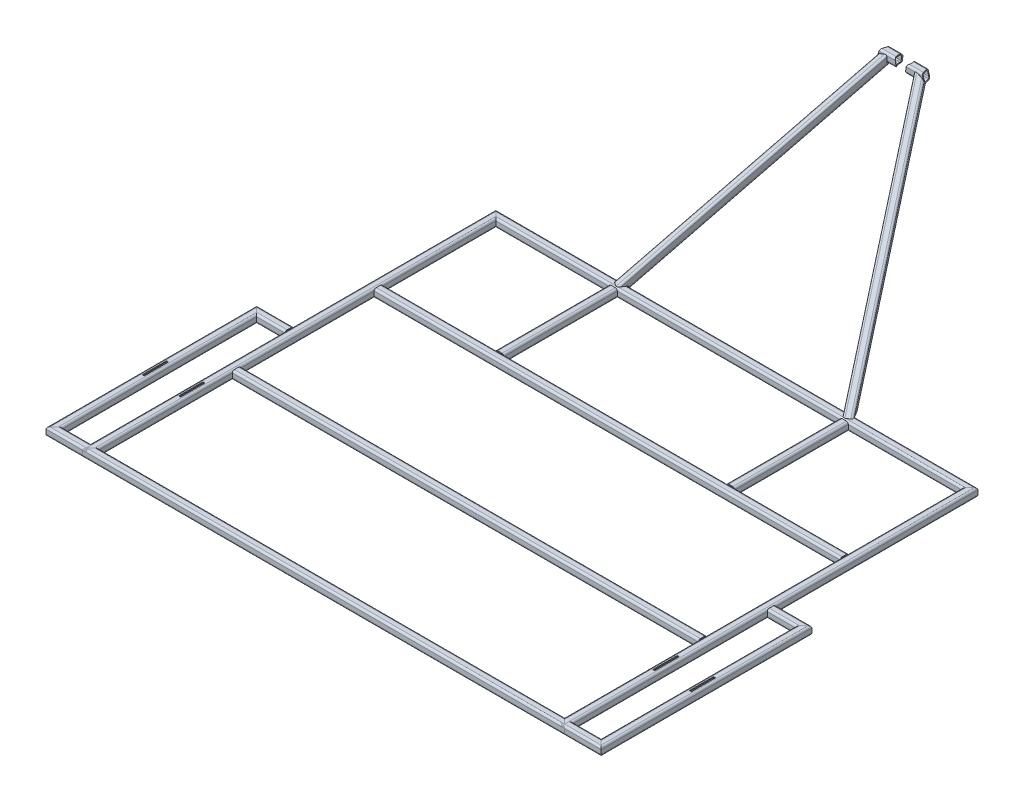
SolidWorks part; units mm, degrees
ref_plane "Front Plane" through (0, 0, 0) normal (0, 0, 1) x (1, 0, 0)
ref_plane "Top Plane" through (0, 0, 0) normal (0, 1, 0) x (1, 0, 0)
ref_plane "Right Plane" through (0, 0, 0) normal (1, 0, 0) x (0, 0, -1)
sketch3d "3DSketch1"
  line L0 (-742.95, 0, -254) -> (742.95, 0, -254)
  line L1 (-742.95, 0, -635) -> (-742.95, 0, 635)
  line L2 (-742.95, 0, -635) -> (742.95, 0, -635)
  line L3 (742.95, 0, -635) -> (742.95, 0, 635)
  line L4 (-742.95, 0, 635) -> (742.95, 0, 635)
  line L5 (-742.95, 0, -635) -> (742.95, 0, 635) construction
  line L6 (742.95, 0, -635) -> (-742.95, 0, 635) construction
  line L7 (742.95, 0, 190.5) -> (-742.95, 0, 190.5)
  line L8 (361.95, 0, -635) -> (361.95, 0, -254)
  line L9 (-361.95, 0, -635) -> (-361.95, 0, -254)
  line L10 (742.95, 0, 635) -> (857.25, 0, 635)
  line L11 (857.25, 0, 0) -> (742.95, 0, 0)
  line L12 (857.25, 0, 635) -> (857.25, 0, 0)
  line L13 (-857.25, 0, 0) -> (-742.95, 0, 0)
  line L14 (-742.95, 0, 635) -> (-857.25, 0, 635)
  line L15 (-857.25, 0, 0) -> (-857.25, 0, 635)
  line L16 (361.95, 0, -444.5) -> (-361.95, 0, -444.5) construction
  line L18 (-50.8, 522.1717, -1173.9276) -> (50.8, 522.1717, -1173.9276)
  line L19 (-361.95, 0, -635) -> (-50.8, 522.1717, -1173.9276)
  line L20 (361.95, 0, -635) -> (50.8, 0, -1173.9276) construction
  line L21 (361.95, 0, -635) -> (50.8, 522.1717, -1173.9276)
  line L22 (309.5644, 0, -604.7552) -> (414.3356, 0, -665.2448) construction
  line L23 (-361.95, 0, -635) -> (361.95, 0, -635) construction
  line L24 (-309.5644, 0, -604.7552) -> (-414.3356, 0, -665.2448) construction
  point P21 (0, 0, -444.5)
  point P23 (0, 0, -635)
  point P28 (0, 522.1717, -1173.9276)
  point P33 (361.95, 0, -635)
  point P34 (-361.95, 0, -635)
other "Sq_rect_tubing_weldment_profiles SQ TUBE 1 X 1 X .120 WALL(1)"
ref_plane "Plane1" through (-742.95, 0, 635) normal (1, 0, 0) x (0, 0, -1)
sketch "Sketch12" plane through (-742.95, 0, 635) normal (1, 0, 0) x (0, 0, -1)
  line L0 (-6.604, -9.652) -> (6.604, -9.652)
  line L1 (-9.652, -6.604) -> (-9.652, 6.604)
  line L2 (6.604, 9.652) -> (-6.604, 9.652)
  line L3 (9.652, 6.604) -> (9.652, -6.604)
  line L4 (-6.604, -12.7) -> (6.604, -12.7)
  line L5 (-12.7, -6.604) -> (-12.7, 6.604)
  line L6 (6.604, 12.7) -> (-6.604, 12.7)
  line L7 (12.7, 6.604) -> (12.7, -6.604)
  line L8 (-12.7, 0) -> (-9.652, 0) construction
  line L9 (-9.652, 0) -> (9.652, 0) construction
  line L10 (9.652, 0) -> (12.7, 0) construction
  line L11 (0, 12.7) -> (0, 9.652) construction
  line L12 (0, 9.652) -> (0, -9.652) construction
  line L13 (0, -9.652) -> (0, -12.7) construction
  arc A0 (12.7, 6.604) -> (6.604, 12.7) centre (6.604, 6.604) ccw
  arc A1 (6.604, -12.7) -> (12.7, -6.604) centre (6.604, -6.604) ccw
  arc A2 (-12.7, -6.604) -> (-6.604, -12.7) centre (-6.604, -6.604) ccw
  arc A3 (-6.604, 12.7) -> (-12.7, 6.604) centre (-6.604, 6.604) ccw
  arc A4 (-6.604, 9.652) -> (-9.652, 6.604) centre (-6.604, 6.604) ccw
  arc A5 (9.652, 6.604) -> (6.604, 9.652) centre (6.604, 6.604) ccw
  arc A6 (6.604, -9.652) -> (9.652, -6.604) centre (6.604, -6.604) ccw
  arc A7 (-9.652, -6.604) -> (-6.604, -9.652) centre (-6.604, -6.604) ccw
  point P6 (-12.7, -12.7)
  point P33 (-12.7, 12.7)
  point P34 (12.7, 12.7)
  point P35 (12.7, 12.7)
  point P36 (12.7, -12.7)
  point P37 (0, 0)
  point P38 (12.7, -12.7)
  point P39 (-12.7, -12.7)
  point P40 (-12.7, 12.7)
  point P41 (-19.05, 0)
  point P42 (0, 19.05)
  point P43 (0, -19.05)
  point P44 (19.05, 0)
  point P45 (0, 0)
sketch "Sketch123" plane through (0, 12.7, 0) normal (0, 1, 0) x (1, 0, 0)
  line L0 (-749.554, -641.604) -> (-736.346, -628.396) construction
  line L1 (-736.346, -628.396) -> (-736.346, 628.396) construction
  line L2 (-736.346, 628.396) -> (-749.554, 641.604) construction
  line L3 (-749.554, 641.604) -> (-749.554, -641.604) construction
  line L4 (-850.646, -6.604) -> (-863.854, 6.604) construction
  line L5 (-863.854, 6.604) -> (-863.854, -641.604) construction
  line L6 (-863.854, -641.604) -> (-850.646, -628.396) construction
  line L7 (-850.646, -628.396) -> (-850.646, -6.604) construction
  line L8 (-749.554, -641.604) -> (-736.346, -628.396) construction
  line L9 (-736.346, -628.396) -> (-736.346, 628.396) construction
  line L10 (755.65, 647.7) -> (749.554, 641.604) construction
  line L11 (-736.346, 628.396) -> (-749.554, 641.604) construction
  line L12 (-749.554, 641.604) -> (-749.554, -641.604) construction
  line L13 (-850.646, -6.604) -> (-863.854, 6.604) construction
  line L14 (736.346, 628.396) -> (730.25, 622.3) construction
  line L15 (-863.854, 6.604) -> (-863.854, -641.604) construction
  line L17 (-863.854, -641.604) -> (-850.646, -628.396) construction
  line L18 (-730.25, 622.3) -> (-736.346, 628.396) construction
  line L19 (-850.646, -628.396) -> (-850.646, -6.604) construction
  line L21 (-863.854, -317.5) -> (-736.346, -317.5) construction
  line L22 (-749.554, 641.604) -> (-755.65, 647.7) construction
  line L23 (-800.1, -380.3051) -> (-800.1, -254.6949) construction
  line L24 (-857.25, 0) -> (-857.25, -635) construction
  line L25 (-860.425, -355.6) -> (-854.075, -355.6)
  line L26 (-860.425, -355.6) -> (-860.425, -279.4)
  line L27 (-860.425, -279.4) -> (-854.075, -279.4)
  line L28 (-854.075, -355.6) -> (-854.075, -279.4)
  line L29 (-860.425, -355.6) -> (-854.075, -279.4) construction
  line L30 (-860.425, -279.4) -> (-854.075, -355.6) construction
  line L31 (-739.775, -279.4) -> (-746.125, -279.4)
  line L42 (755.65, 647.7) -> (749.554, 641.604) construction
  line L46 (736.346, 628.396) -> (730.25, 622.3) construction
  line L50 (-730.25, 622.3) -> (-736.346, 628.396) construction
  line L54 (-749.554, 641.604) -> (-755.65, 647.7) construction
  line L64 (-746.125, -355.6) -> (-746.125, -279.4)
  line L65 (-739.775, -355.6) -> (-746.125, -355.6)
  line L70 (-739.775, -355.6) -> (-739.775, -279.4)
  line L71 (860.425, -279.4) -> (854.075, -355.6) construction
  line L72 (860.425, -355.6) -> (854.075, -279.4) construction
  line L77 (0, 0) -> (0, -50000) construction
  line L86 (800.1, -380.3051) -> (800.1, -254.6949) construction
  line L87 (863.854, -317.5) -> (736.346, -317.5) construction
  line L88 (739.775, -355.6) -> (739.775, -279.4)
  line L89 (739.775, -355.6) -> (746.125, -355.6)
  line L90 (746.125, -355.6) -> (746.125, -279.4)
  line L91 (739.775, -279.4) -> (746.125, -279.4)
  line L92 (854.075, -355.6) -> (854.075, -279.4)
  line L93 (860.425, -279.4) -> (854.075, -279.4)
  line L94 (860.425, -355.6) -> (860.425, -279.4)
  line L95 (860.425, -355.6) -> (854.075, -355.6)
  point P8 (-857.25, -317.5)
  point P13 (-800.1, -317.5)
  point P42 (800.1, -317.5)
  point P43 (857.25, -317.5)
  dimension "D1" = 6.35
  dimension "D2" = 76.2
extrude "Cut-Extrude1" cut sketch "Sketch123" against normal up to surface (25.4 mm away)
sketch3d "3DSketch2" [suppressed]
  line L0 (361.95, 0, -635) -> (361.95, 12.7, -635) construction
  line L1 (-361.95, 0, -635) -> (-361.95, 12.7, -635) construction
  line L2 (-361.95, 12.7, -635) -> (-50.8, 534.5064, -1312.1512)
  line L3 (-50.8, 534.5064, -1312.1512) -> (50.8, 534.5064, -1312.1512)
  line L4 (361.95, 12.7, -635) -> (50.8, 534.5064, -1312.1512)
  line L5 (-361.95, 12.7, -635) -> (361.95, 12.7, -635) construction
  line L6 (361.95, 12.7, -635) -> (50.8, 12.7, -1312.1512) construction
  line L7 (-361.95, 12.7, -635) -> (-366.2937, 5.4156, -625.547)
  line L8 (361.95, 12.7, -635) -> (366.2937, 5.4156, -625.547)
  point P8 (0, 534.5064, -1312.1512)
other "Sq_rect_tubing_weldment_profiles SQ TUBE 1 X 1 X .120 WALL(7)"
ref_plane "Plane3" through (-50.8, 534.8717, -1173.9276) normal (1, 0, 0) x (0, 0, -1)
sketch "Sketch126" plane through (-50.8, 534.8717, -1173.9276) normal (1, 0, 0) x (0, 0, -1)
  line L0 (-6.604, -9.652) -> (6.604, -9.652)
  line L1 (-9.652, -6.604) -> (-9.652, 6.604)
  line L2 (6.604, 9.652) -> (-6.604, 9.652)
  line L3 (9.652, 6.604) -> (9.652, -6.604)
  line L4 (-6.604, -12.7) -> (6.604, -12.7)
  line L5 (-12.7, -6.604) -> (-12.7, 6.604)
  line L6 (6.604, 12.7) -> (-6.604, 12.7)
  line L7 (12.7, 6.604) -> (12.7, -6.604)
  line L8 (-12.7, 0) -> (-9.652, 0) construction
  line L9 (-9.652, 0) -> (9.652, 0) construction
  line L10 (9.652, 0) -> (12.7, 0) construction
  line L11 (0, 12.7) -> (0, 9.652) construction
  line L12 (0, 9.652) -> (0, -9.652) construction
  line L13 (0, -9.652) -> (0, -12.7) construction
  arc A0 (12.7, 6.604) -> (6.604, 12.7) centre (6.604, 6.604) ccw
  arc A1 (6.604, -12.7) -> (12.7, -6.604) centre (6.604, -6.604) ccw
  arc A2 (-12.7, -6.604) -> (-6.604, -12.7) centre (-6.604, -6.604) ccw
  arc A3 (-6.604, 12.7) -> (-12.7, 6.604) centre (-6.604, 6.604) ccw
  arc A4 (-6.604, 9.652) -> (-9.652, 6.604) centre (-6.604, 6.604) ccw
  arc A5 (9.652, 6.604) -> (6.604, 9.652) centre (6.604, 6.604) ccw
  arc A6 (6.604, -9.652) -> (9.652, -6.604) centre (6.604, -6.604) ccw
  arc A7 (-9.652, -6.604) -> (-6.604, -9.652) centre (-6.604, -6.604) ccw
  point P6 (-12.7, -12.7)
  point P33 (-12.7, 12.7)
  point P34 (12.7, 12.7)
  point P35 (12.7, 12.7)
  point P36 (12.7, -12.7)
  point P37 (0, 0)
  point P38 (12.7, -12.7)
  point P39 (-12.7, -12.7)
  point P40 (-12.7, 12.7)
  point P41 (-19.05, 0)
  point P42 (0, 19.05)
  point P43 (0, -19.05)
  point P44 (19.05, 0)
  point P45 (0, 0)
sketch3d "3DSketch4" [suppressed] plane through (0, 0, 0) normal (0, 0, 1) x (1, 0, 0)
  dimension "D1" = 350
ref_plane "Plane4" [suppressed] through (0, 249.0296, 54.5637) normal (0, 0.9768, 0.214) x (1, 0, 0)
sketch "Sketch128" [suppressed] plane through (0, 249.0296, 54.5637) normal (0, 0.9768, 0.214) x (1, 0, 0)
  line L0 (0, 1404.8538) -> (0, 1391.8465) construction
  line L1 (-59.7094, 1404.8538) -> (59.7094, 1404.8538) construction
  line L2 (-52.1576, 1391.8465) -> (52.1576, 1391.8465) construction
  circle A0 centre (0, 1398.3501) radius 21.844
  dimension "D1" = 43.688
extrude "Cut-Extrude2" [suppressed] cut sketch "Sketch128" against normal up to surface and the other way up to surface contours A0
ref_plane "Plane5" through (0, 319.1193, 56.2693) normal (0, 0.9848, 0.1736) x (-1, 0, 0)
sketch "Sketch129" plane through (0, 319.1193, 56.2693) normal (0, 0.9848, 0.1736) x (-1, 0, 0)
  line L0 (0, -1242.4688) -> (0, -1255.4762) construction
  line L1 (-64.8915, -1242.4688) -> (64.8915, -1242.4688) construction
  line L2 (-60.9583, -1255.4762) -> (60.9583, -1255.4762) construction
  circle A0 centre (0, -1248.9725) radius 21.844
  point P8 (0, -1248.9725)
  dimension "D1" = 43.688
extrude "Cut-Extrude3" cut sketch "Sketch129" against normal up to surface and the other way up to surface
equation "\"D1@Sketch12\"= \"Thickness@Sketch12\""
equation "\"D8@3DSketch1\"=\"D7@3DSketch1\""
equation "\"D1@Sketch126\"= \"Thickness@Sketch126\""
equation "\"D5@3DSketch2\"=\"D4@3DSketch2\""
